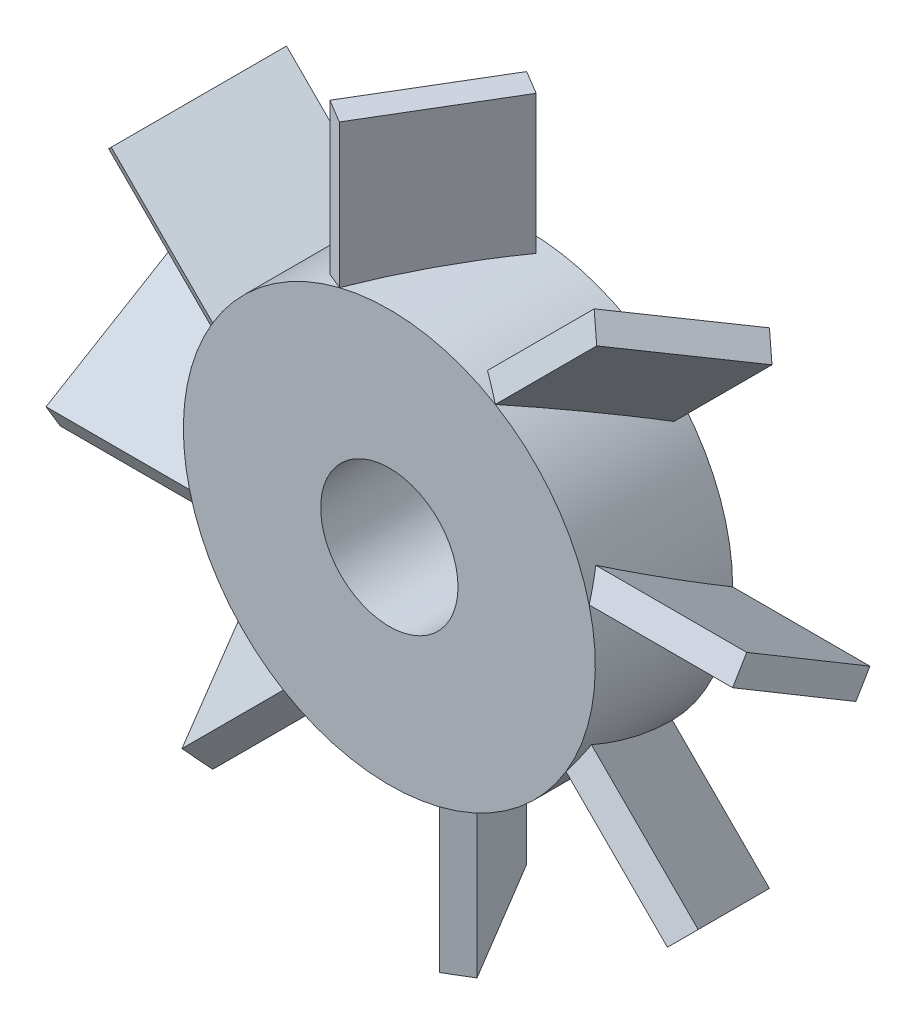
SolidWorks part; units mm, degrees
ref_plane "Front" through (0, 0, 0) normal (0, 0, 1) x (1, 0, 0)
ref_plane "Top" through (0, 0, 0) normal (0, 1, 0) x (1, 0, 0)
ref_plane "Right" through (0, 0, 0) normal (1, 0, 0) x (0, 0, -1)
sketch "Sketch1" plane through (0, 0, 0) normal (0, 0, 1) x (1, 0, 0)
  circle A0 centre (0, 0) radius 7.5
  dimension "D1" = 15
extrude "Base-Extrude" add sketch "Sketch1" along normal blind 5
sketch "Sketch2" plane through (0, 0, 0) normal (0, 1, 0) x (1, 0, 0)
  line L0 (0, 0) -> (-2.6785, -4.4875)
  line L1 (7.5, 0) -> (-7.5, 0) construction
  line L2 (-2.6785, -4.4875) -> (-1.8199, -5)
  line L3 (7.5, -5) -> (-7.5, -5) construction
  line L6 (-1.8199, -5) -> (0.8587, -0.5125)
  line L7 (0, 0) -> (0.8587, -0.5125)
  line L8 (0, 0) -> (-1.8199, -5) construction
  line L9 (-2.6785, -4.4875) -> (0.8587, -0.5125) construction
  dimension "D1" = 1
  dimension "D2" = 110
extrude "Boss-Extrude1" add sketch "Sketch2" along normal blind 12.5
pattern_circular "CirPattern1" count 8 every 45
sketch "Sketch3" plane through (0, 0, 5) normal (0, 0, 1) x (1, 0, 0)
  circle A0 centre (0, 0) radius 2.5
  dimension "D1" = 5
extrude "Cut-Extrude1" cut sketch "Sketch3" against normal through all
